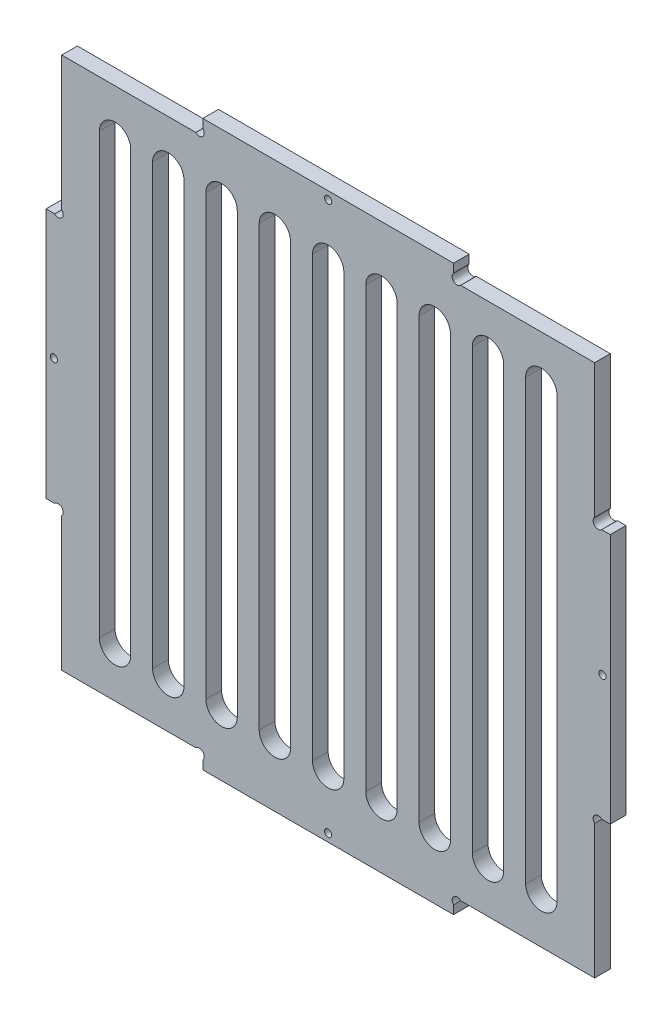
SolidWorks part; units mm, degrees
ref_plane "Plan de face" through (0, 0, 0) normal (0, 0, 1) x (1, 0, 0)
ref_plane "Plan de dessus" through (0, 0, 0) normal (0, 1, 0) x (1, 0, 0)
ref_plane "Plan de droite" through (0, 0, 0) normal (1, 0, 0) x (0, 0, -1)
sketch "Esquisse1" plane through (0, 0, 0) normal (0, 0, 1) x (1, 0, 0)
  line L0 (50, 180) -> (0, 180) construction
  line L1 (0, 0) -> (180, 0)
  line L2 (0, 0) -> (0, 180)
  line L3 (0, 180) -> (180, 180)
  line L4 (180, 0) -> (180, 180)
  line L5 (180, 127.7373) -> (180, 52.2627) construction
extrude "Boss.-Extru.1" add sketch "Esquisse1" along normal blind 5
sketch "Esquisse2" plane through (0, 0, 0) normal (0, 0, -1) x (-1, 0, 0)
  line L0 (-180, 0) -> (-180, 180) construction
  line L1 (-180, 130) -> (-175, 130)
  line L2 (-180, 130) -> (-180, 180)
  line L3 (-180, 50) -> (-175, 50)
  line L4 (-180, 180) -> (-130, 180)
  line L5 (0, 0) -> (-180, 0) construction
  line L6 (-50, 180) -> (0, 180)
  line L7 (-130, 0) -> (-130, 5)
  line L8 (0, 180) -> (0, 130)
  line L9 (-50, 0) -> (-50, 5)
  line L10 (0, 180) -> (0, 0) construction
  line L11 (0, 130) -> (-5, 130)
  line L12 (0, 50) -> (0, 0)
  line L13 (0, 50) -> (-5, 50)
  line L14 (0, 0) -> (-50, 0)
  line L15 (-180, 180) -> (0, 180) construction
  line L16 (-130, 0) -> (-180, 0)
  line L17 (-130, 180) -> (-130, 175)
  line L18 (-180, 0) -> (-180, 50)
  line L19 (-50, 180) -> (-50, 175)
  line L20 (-180, 90) -> (0, 90) construction
  line L21 (-90, 180) -> (-90, 0) construction
  line L22 (-130, 175) -> (-175, 175)
  line L23 (-175, 175) -> (-175, 130)
  line L25 (-175, 50) -> (-175, 5)
  line L26 (-175, 5) -> (-130, 5)
  line L27 (-5, 50) -> (-5, 5)
  line L28 (-5, 5) -> (-50, 5)
  line L29 (-50, 175) -> (-5, 175)
  line L30 (-5, 175) -> (-5, 130)
  dimension "D1" = 5
  dimension "D2" = 5
  dimension "D3" = 5
  dimension "D4" = 5
  dimension "D5" = 80
  dimension "D6" = 80
extrude "Enlèv. mat.-Extru.1" cut sketch "Esquisse2" against normal through all
sketch "Esquisse4" plane through (0, 0, 0) normal (0, 0, -1) x (-1, 0, 0)
  line L0 (-130, 175) -> (-132.2627, 177.2627) construction
  line L1 (-130, 175) -> (-130, 180) construction
  line L2 (-90, 180) -> (-90, 161.3523) construction
  line L3 (-130, 180) -> (-50, 180) construction
  line L4 (-50, 175) -> (-47.7373, 177.2627) construction
  line L5 (-5, 175) -> (-175, 5) construction
  line L6 (-5, 130) -> (-2.7373, 132.2627) construction
  line L7 (-5, 50) -> (-2.7373, 47.7373) construction
  line L8 (-175, 175) -> (-5, 5) construction
  line L9 (-50, 5) -> (-47.7373, 2.7373) construction
  line L10 (-130, 5) -> (-132.2627, 2.7373) construction
  line L11 (-175, 50) -> (-177.2627, 47.7373) construction
  line L12 (-175, 130) -> (-177.2627, 132.2627) construction
  circle A0 centre (-131.1314, 176.1314) radius 1.6
  circle A1 centre (-48.8686, 176.1314) radius 1.6
  circle A2 centre (-3.8686, 131.1314) radius 1.6
  circle A3 centre (-3.8686, 48.8686) radius 1.6
  circle A4 centre (-48.8686, 3.8686) radius 1.6
  circle A5 centre (-131.1314, 3.8686) radius 1.6
  circle A6 centre (-176.1314, 48.8686) radius 1.6
  circle A7 centre (-176.1314, 131.1314) radius 1.6
  dimension "D1" = 3.2
  dimension "D2" = 45
extrude "Enlèv. mat.-Extru.3" cut sketch "Esquisse4" against normal through all
sketch "Esquisse5" plane through (0, 0, 0) normal (0, 0, -1) x (-1, 0, 0)
  line L3 (-130, 180) -> (-50, 180) construction
  line L6 (-5, 175) -> (-175, 5) construction
  line L7 (-175, 175) -> (-5, 5) construction
  line L8 (-130, 177.2627) -> (-130, 180) construction
  circle A0 centre (-90, 177.5) radius 1.15
  circle A1 centre (-2.5, 90) radius 1.15
  circle A2 centre (-90, 2.5) radius 1.15
  circle A3 centre (-177.5, 90) radius 1.15
  dimension "D1" = 2.5
  dimension "D2" = 2.3
  dimension "D3" = 40
extrude "Enlèv. mat.-Extru.4" cut sketch "Esquisse5" against normal through all
sketch "Esquisse6" plane through (0, 0, 0) normal (0, 0, -1) x (-1, 0, 0)
  line L0 (-90, 177.5) -> (-90, 2.5) construction
  line L1 (-90, 160) -> (-90, 20) construction
  line L2 (-85, 160) -> (-85, 20)
  line L3 (-95, 160) -> (-95, 20)
  line L4 (-175, 175) -> (-132.2627, 175) construction
  line L5 (-5, 5) -> (-47.7373, 5) construction
  arc A0 (-85, 160) -> (-95, 160) centre (-90, 160) ccw
  arc A1 (-95, 20) -> (-85, 20) centre (-90, 20) ccw
  point P6 (-90, 90)
  dimension "D1" = 15
  dimension "D2" = 10
  dimension "D3" = 15
extrude "Enlèv. mat.-Extru.5" cut sketch "Esquisse6" against normal through all
pattern_linear "Répétition linéaire1" count 5 spacing 17 along (1, 0, 0) count 5 spacing 17 along (-1, 0, 0) of "Enlèv. mat.-Extru.5"
